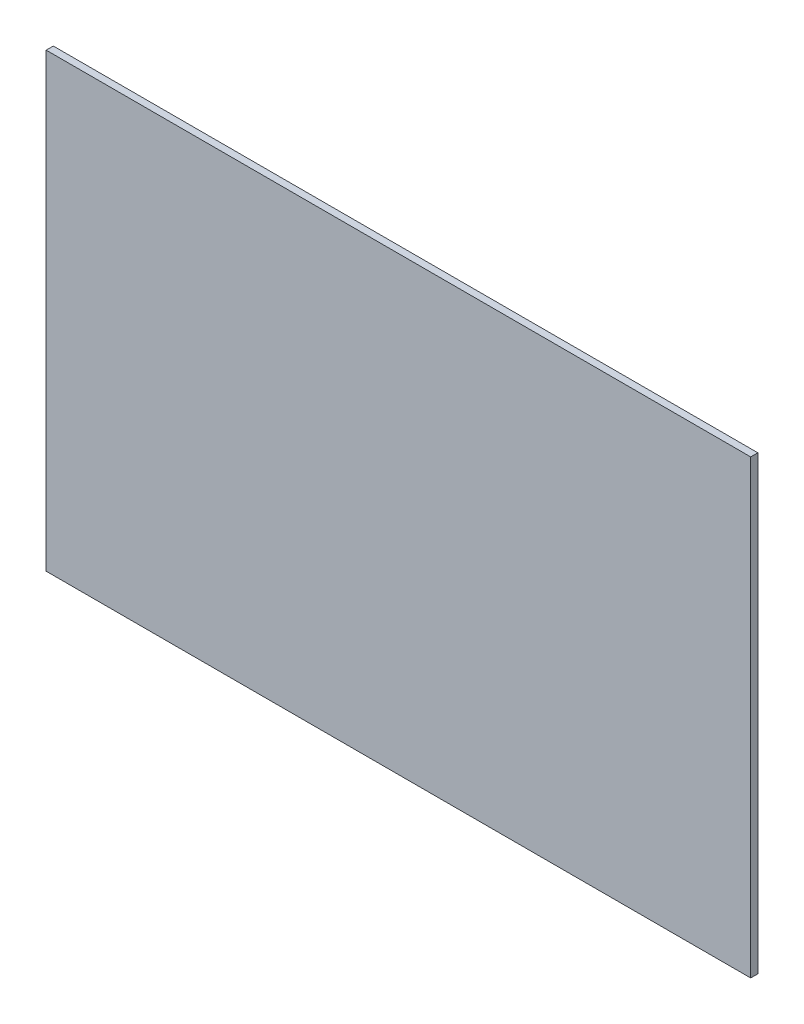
SolidWorks part; units mm, degrees
ref_plane "Front Plane" through (0, 0, 0) normal (0, 0, 1) x (1, 0, 0)
ref_plane "Top Plane" through (0, 0, 0) normal (0, 1, 0) x (1, 0, 0)
ref_plane "Right Plane" through (0, 0, 0) normal (1, 0, 0) x (0, 0, -1)
sketch "Sketch1" plane through (0, 0, 0) normal (0, 0, 1) x (1, 0, 0)
  line L1 (-74, 98.5) -> (74, 98.5)
  line L2 (-74, 98.5) -> (-74, 3.7071)
  line L3 (-74, 3.7071) -> (74, 3.7071)
  line L4 (74, 98.5) -> (74, 3.7071)
base flange "Base-Flange1" sketch "Sketch1" thickness 1.5 reverse thickness direction yes parameters "D1"=5
sketch "Bend-Lines1" [suppressed] plane through (0, 0, 0) normal (0, 1, 0) x (1, 0, 0)
sketch "Bounding-Box1" [suppressed] plane through (0, 0, 0) normal (0, 1, 0) x (1, 0, 0)
sheet metal parameters "Sheet-Metal1" thickness 1.5 parameters "D1"=5
flat pattern "Flat-Pattern1"
sketch "Bend-Lines2" plane through (0, 0, 0) normal (0, 1, 0) x (1, 0, 0)
sketch3d "Bounding-Box2" [suppressed]
  line L0 (-74, 3.7071, 0) -> (74, 3.7071, 0) construction
  line L1 (-74, 98.5, 0) -> (74, 98.5, 0) construction
  line L2 (-74, 3.7071, 0) -> (-74, 98.5, 0) construction
  line L3 (74, 3.7071, 0) -> (74, 98.5, 0) construction
